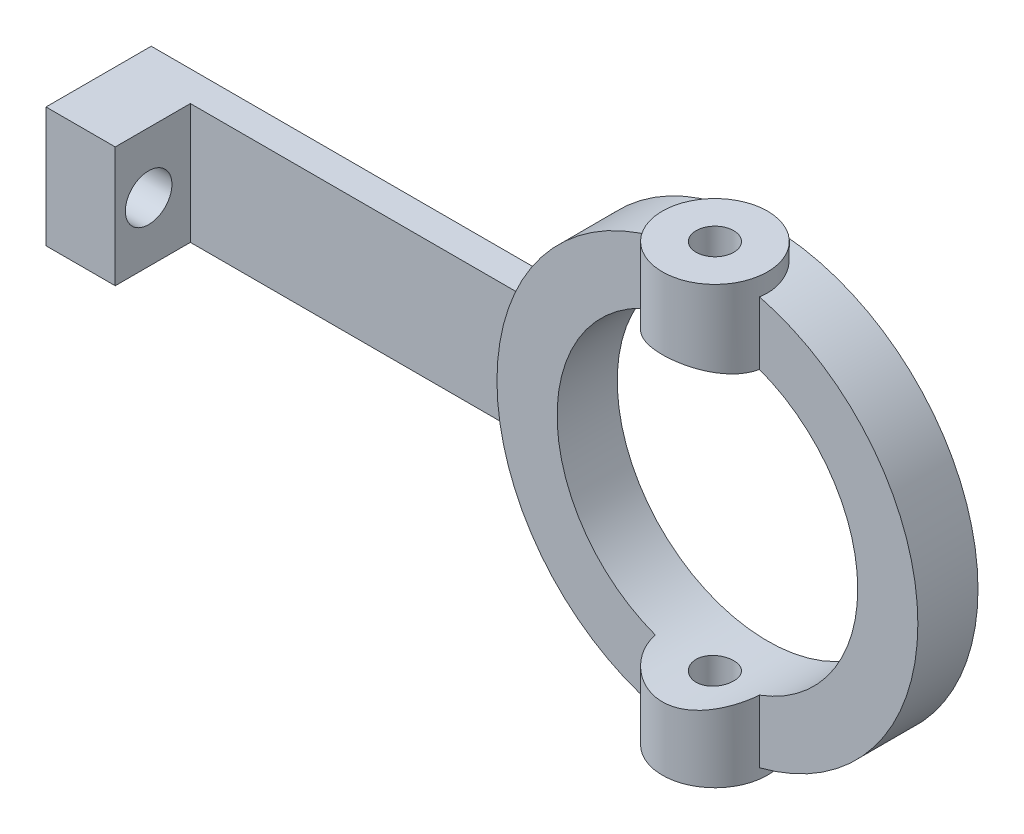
SolidWorks part; units mm, degrees
ref_plane "Plan de face" through (0, 0, 0) normal (0, 0, 1) x (1, 0, 0)
ref_plane "Plan de dessus" through (0, 0, 0) normal (0, 1, 0) x (1, 0, 0)
ref_plane "Plan de droite" through (0, 0, 0) normal (1, 0, 0) x (0, 0, -1)
sketch "Esquisse1" plane through (0, 0, 0) normal (0, 0, 1) x (1, 0, 0)
  line L1 (-359.8611, 48.6957) -> (-329.8611, 48.6957)
  line L2 (-359.8611, 48.6957) -> (-359.8611, 40.6957)
  line L3 (-359.8611, 40.6957) -> (-329.8611, 40.6957)
  line L4 (-329.8611, 48.6957) -> (-329.8611, 40.6957)
  dimension "D1" = 8
  dimension "D2" = 30
extrude "Boss.-Extru.1" add sketch "Esquisse1" along normal blind 2
sketch "Esquisse2" plane through (0, 40.6957, 0) normal (0, -1, 0) x (1, 0, 0)
  line L0 (-329.8611, 0) -> (-359.8611, 0) construction
  line L1 (-329.8611, 2) -> (-329.8611, 0) construction
  circle A0 centre (-318.8611, 3.5) radius 3.5
  dimension "D1" = 7
  dimension "D2" = 11
extrude "Boss.-Extru.2" add sketch "Esquisse2" along normal blind 10 and the other way blind 19 separate body
sketch "Esquisse3" plane through (0, 0, 0) normal (0, 0, -1) x (-1, 0, 0)
  line L0 (329.8611, 40.6957) -> (329.8611, 48.6957) construction
  circle A0 centre (318.8611, 44.9225) radius 14
  dimension "D1" = 11
  dimension "D2" = 28
extrude "Boss.-Extru.3" add sketch "Esquisse3" against normal blind 4
sketch "Esquisse4" plane through (0, 0, 4) normal (0, 0, 1) x (1, 0, 0)
  circle A0 centre (-318.8611, 44.9225) radius 10
  dimension "D1" = 20
extrude "Enlèv. mat.-Extru.1" cut sketch "Esquisse4" against normal through all and the other way through all
sketch "Esquisse5" plane through (0, 30.6957, 0) normal (0, -1, 0) x (1, 0, 0)
  circle A0 centre (-318.8611, 3.5) radius 1.25
  dimension "D1" = 2.5
extrude "Enlèv. mat.-Extru.2" cut sketch "Esquisse5" against normal through all both and the other way through all
sketch "Esquisse6" plane through (0, 0, 2) normal (0, 0, 1) x (1, 0, 0)
  line L0 (-359.8611, 40.6957) -> (-332.2078, 40.6957) construction
  line L1 (-359.8611, 48.6957) -> (-355.2556, 48.6957)
  line L2 (-359.8611, 48.6957) -> (-359.8611, 40.6957)
  line L3 (-359.8611, 40.6957) -> (-355.2556, 40.6957)
  line L4 (-355.2556, 48.6957) -> (-355.2556, 40.6957)
extrude "Boss.-Extru.4" add sketch "Esquisse6" along normal blind 5
sketch "Esquisse7" plane through (-359.8611, 0, 0) normal (-1, 0, 0) x (0, 0, 1)
  circle A0 centre (4.778, 44.6596) radius 1.55
  point P0 (4.778, 44.6596)
  dimension "D1" = 3.1
extrude "Enlèv. mat.-Extru.3" cut sketch "Esquisse7" against normal blind 5
